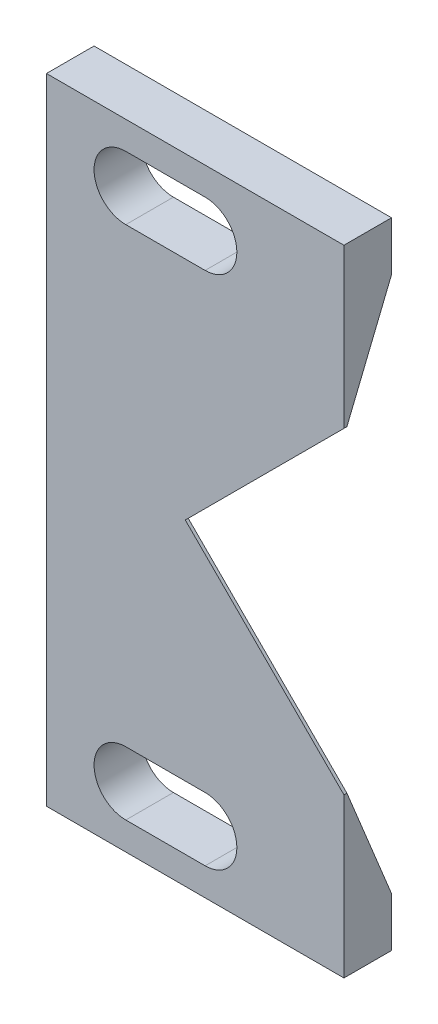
SolidWorks part; units mm, degrees
ref_plane "FACE" through (0, 0, 0) normal (0, 0, 1) x (1, 0, 0)
ref_plane "DESSUS" through (0, 0, 0) normal (0, 1, 0) x (1, 0, 0)
ref_plane "GAUCHE" through (0, 0, 0) normal (1, 0, 0) x (0, 0, -1)
sketch "Esquisse1" plane through (0, 0, 0) normal (0, 0, 1) x (1, 0, 0)
  line L0 (0, 0) -> (0, 32)
  line L1 (0, 32) -> (15, 32)
  line L2 (15, 32) -> (15, 24)
  line L3 (15, 24) -> (7, 16)
  line L4 (7, 16) -> (15, 8)
  line L5 (15, 8) -> (15, 0)
  line L6 (15, 0) -> (0, 0)
  line L7 (4, 4.6) -> (8, 4.6)
  line L8 (4, 1.4) -> (8, 1.4)
  line L9 (-10, 16) -> (23, 16) construction
  line L10 (4, 30.6) -> (8, 30.6)
  line L11 (4, 27.4) -> (8, 27.4)
  arc A0 (4, 4.6) -> (4, 1.4) centre (4, 3) ccw
  arc A1 (8, 1.4) -> (8, 4.6) centre (8, 3) ccw
  arc A2 (8, 30.6) -> (8, 27.4) centre (8, 29) cw
  arc A3 (4, 27.4) -> (4, 30.6) centre (4, 29) cw
  dimension "D6" = 3.2
  dimension "D7" = 4
  dimension "D1" = 32
  dimension "D2" = 15
  dimension "D3" = 16
  dimension "D4" = 45
  dimension "D5" = 16
  dimension "D8" = 8
  dimension "D9" = 3
extrude "Exterieur" add sketch "Esquisse1" along normal blind 2.4
chamfer "Chanfrein1" distance 3.9 angle 30
